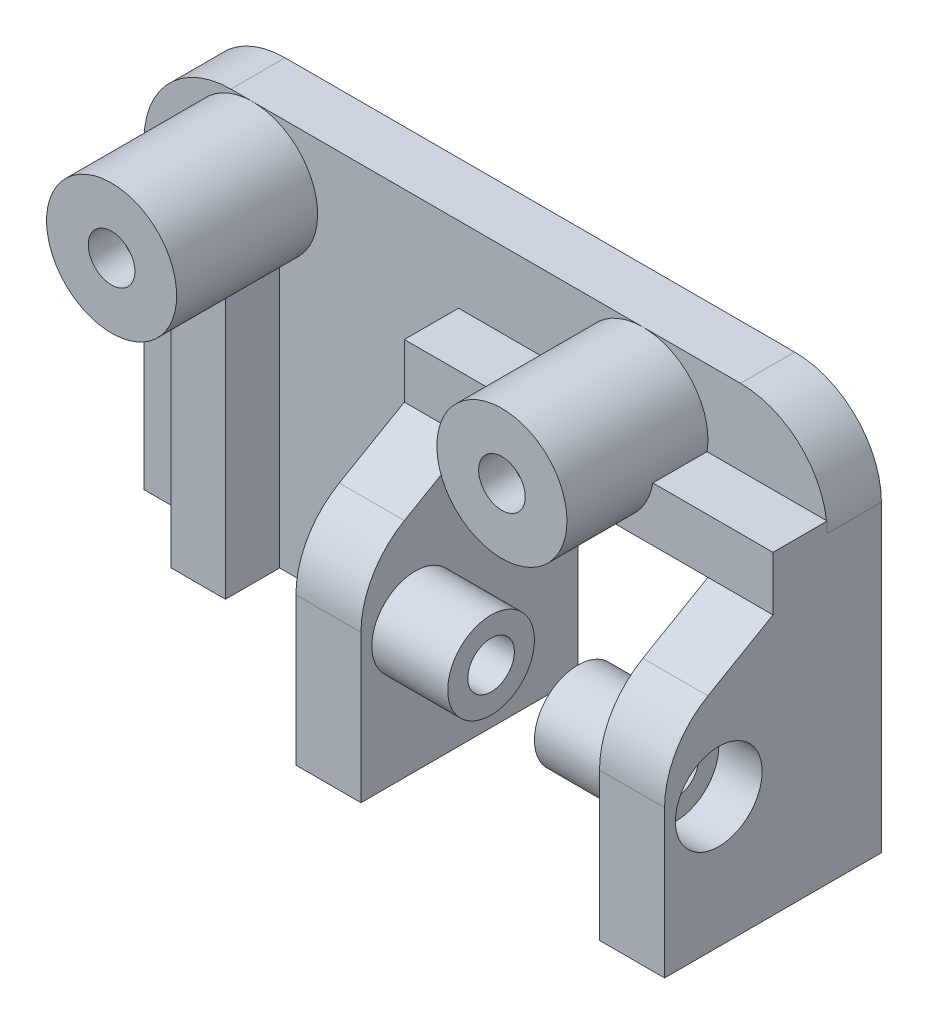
SolidWorks part; units mm, degrees
ref_plane "Plan de face" through (0, 0, 0) normal (0, 0, 1) x (1, 0, 0)
ref_plane "Plan de dessus" through (0, 0, 0) normal (0, 1, 0) x (1, 0, 0)
ref_plane "Plan de droite" through (0, 0, 0) normal (1, 0, 0) x (0, 0, -1)
sketch "Esquisse1" plane through (0, 0, 0) normal (0, 0, 1) x (1, 0, 0)
  line L0 (57, 0) -> (63, 0)
  line L1 (0, 0) -> (35, 0)
  line L2 (0, 0) -> (0, 28)
  line L3 (8, 36) -> (55, 36)
  line L4 (63, 0) -> (63, 28)
  line L6 (35, 0) -> (35, 24)
  line L7 (35, 24) -> (57, 24)
  line L8 (57, 0) -> (57, 24)
  arc A0 (55, 36) -> (63, 28) centre (55, 28) cw
  arc A1 (0, 28) -> (8, 36) centre (8, 28) cw
  dimension "D3" = 8
  dimension "D1" = 63
  dimension "D2" = 36
  dimension "D4" = 6
  dimension "D5" = 22
  dimension "D6" = 24
extrude "Boss.-Extru.1" add sketch "Esquisse1" along normal blind 5
sketch "Esquisse3" plane through (0, 0, 5) normal (0, 0, 1) x (1, 0, 0)
  line L0 (0, 0) -> (35, 0) construction
  line L1 (0, 28) -> (0, 0) construction
  circle A0 centre (10, 30) radius 6
  circle A1 centre (46, 30) radius 6
  dimension "D1" = 12
  dimension "D2" = 12
  dimension "D6" = 36
  dimension "D3" = 30
  dimension "D4" = 30
  dimension "D5" = 10
extrude "Boss.-Extru.3" add sketch "Esquisse3" along normal blind 13
sketch "Esquisse4" plane through (0, 0, 0) normal (0, 0, -1) x (-1, 0, 0)
  circle A0 centre (-46, 30) radius 4
  circle A1 centre (-10, 30) radius 4
  dimension "D1" = 8
  dimension "D2" = 8
extrude "Enlèv. mat.-Extru.1" cut sketch "Esquisse4" against normal blind 15
sketch "Esquisse5" plane through (0, 0, 18) normal (0, 0, 1) x (1, 0, 0)
  circle A0 centre (10, 30) radius 2.15
  circle A1 centre (46, 30) radius 2.15
  dimension "D1" = 4.3
  dimension "D2" = 4.3
extrude "Enlèv. mat.-Extru.2" cut sketch "Esquisse5" against normal up to next
sketch "Esquisse6" plane through (63, 0, 0) normal (1, 0, 0) x (0, 0, -1)
  line L0 (-10, 24) -> (-16, 20.5359)
  line L1 (-5, 0) -> (-20, 0)
  line L2 (-5, 0) -> (-5, 29)
  line L4 (-20, 0) -> (-20, 13.6077)
  line L5 (-5, 24) -> (0, 24) construction
  line L8 (-5, 29) -> (-10, 29)
  line L9 (-10, 24) -> (-10, 29)
  arc A0 (-16, 20.5359) -> (-20, 13.6077) centre (-12, 13.6077) ccw
  dimension "D5" = 8
  dimension "D1" = 15
  dimension "D2" = 120
  dimension "D3" = 5
  dimension "D4" = 5
extrude "Boss.-Extru.4" add sketch "Esquisse6" against normal blind 6 separate body
pattern_linear "Répétition linéaire1" count 2 spacing 28 along (-1, 0, 0) of "Boss.-Extru.4"
sketch "Esquisse7" plane through (57, 0, 0) normal (-1, 0, 0) x (0, 0, 1)
  line L1 (5, 29) -> (10, 29)
  line L2 (5, 29) -> (5, 24)
  line L3 (5, 24) -> (10, 24)
  line L4 (10, 29) -> (10, 24)
extrude "Boss.-Extru.5" add sketch "Esquisse7" along normal up to next
sketch "Esquisse8" plane through (35, 0, 0) normal (1, 0, 0) x (0, 0, -1)
  line L1 (-5, 29) -> (-10, 29)
  line L2 (-5, 29) -> (-5, 24)
  line L3 (-5, 24) -> (-10, 24)
  line L4 (-10, 29) -> (-10, 24)
extrude "Boss.-Extru.6" add sketch "Esquisse8" along normal up to next
sketch "Esquisse9" plane through (0, 0, 0) normal (0, -1, 0) x (1, 0, 0)
  line L0 (0, 5) -> (29, 5) construction
  line L1 (7.5, 5) -> (12.5, 5)
  line L2 (7.5, 5) -> (7.5, 10)
  line L3 (7.5, 10) -> (12.5, 10)
  line L4 (12.5, 5) -> (12.5, 10)
  line L5 (10, 18) -> (10, 5) construction
  dimension "D1" = 5
  dimension "D2" = 2.5
  dimension "D3" = 5
extrude "Boss.-Extru.7" add sketch "Esquisse9" against normal up to next
sketch "Esquisse10" plane through (57, 0, 0) normal (-1, 0, 0) x (0, 0, 1)
  line L0 (15, 32.15) -> (15, 27.85) construction
  line L1 (20, 0) -> (0, 0) construction
  circle A0 centre (15, 12) radius 4
  dimension "D1" = 8
  dimension "D2" = 12
extrude "Boss.-Extru.8" add sketch "Esquisse10" along normal blind 7
sketch "Esquisse11" plane through (35, 0, 0) normal (1, 0, 0) x (0, 0, -1)
  line L0 (-20, 0) -> (0, 0) construction
  line L1 (-15, 27.85) -> (-15, 32.15) construction
  circle A0 centre (-15, 12) radius 4
  point P4 (0, 0)
  dimension "D1" = 8
  dimension "D2" = 12
extrude "Boss.-Extru.9" add sketch "Esquisse11" along normal blind 7
sketch "Esquisse12" plane through (63, 0, 0) normal (1, 0, 0) x (0, 0, -1)
  circle A0 centre (-15, 12) radius 4
  dimension "D1" = 8
extrude "Enlèv. mat.-Extru.3" cut sketch "Esquisse12" against normal blind 4
sketch "Esquisse13" plane through (29, 0, 0) normal (-1, 0, 0) x (0, 0, 1)
  line L1 (19, 9.6906) -> (19, 14.3094)
  line L2 (19, 14.3094) -> (15, 16.6188)
  line L3 (15, 16.6188) -> (11, 14.3094)
  line L4 (11, 14.3094) -> (11, 9.6906)
  line L5 (11, 9.6906) -> (15, 7.3812)
  line L6 (15, 7.3812) -> (19, 9.6906)
  line L7 (20, 13.6077) -> (20, 0) construction
  circle A0 centre (15, 12) radius 4 construction
  point P1 (13.8162, 11.6161)
  point P10 (12.1503, 11.3554)
  point P13 (15, 12)
  point P16 (12, 13.6077)
  point P18 (12.7495, 10.6482)
  point P19 (11.8476, 11.0013)
  point P20 (15, 12.8262)
  point P21 (15.1731, 12.8262)
  point P22 (15, 12)
  dimension "D1" = 8
extrude "Enlèv. mat.-Extru.4" cut sketch "Esquisse13" against normal blind 4
sketch "Esquisse14" plane through (59, 0, 0) normal (1, 0, 0) x (0, 0, -1)
  circle A0 centre (-15, 12) radius 2.15
  dimension "D1" = 4.3
extrude "Enlèv. mat.-Extru.5" cut sketch "Esquisse14" against normal up to surface (26 mm away)
